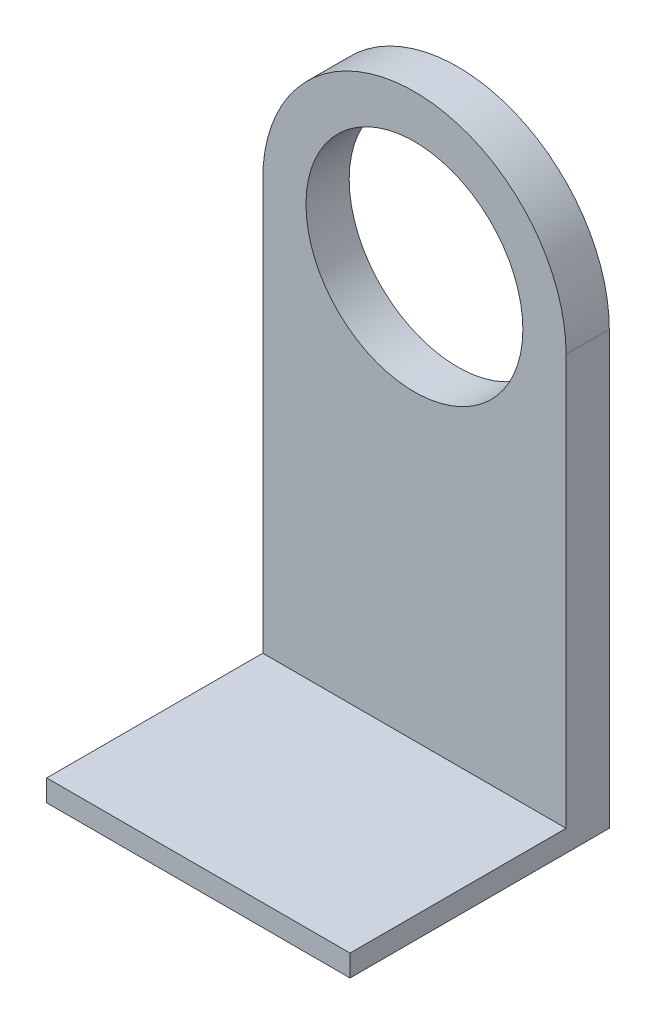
SolidWorks part; units mm, degrees
ref_plane "Front Plane" through (0, 0, 0) normal (0, 0, 1) x (1, 0, 0)
ref_plane "Top Plane" through (0, 0, 0) normal (0, 1, 0) x (1, 0, 0)
ref_plane "Right Plane" through (0, 0, 0) normal (1, 0, 0) x (0, 0, -1)
sketch "Sketch1" plane through (0, 0, 0) normal (0, 0, 1) x (1, 0, 0)
  line L0 (44.575, 0) -> (44.575, -127)
  line L1 (44.575, -127) -> (-44.575, -127)
  line L2 (-44.575, 0) -> (-44.575, -127)
  circle A0 centre (0, 0) radius 31.875
  arc A1 (44.575, 0) -> (-44.575, 0) centre (0, 0) ccw
  circle A2 centre (0, 0) radius 44.575 construction
  dimension "D1" = 63.75
  dimension "D3" = 127
  dimension "D2" = 12.7
extrude "Extrude1" add sketch "Sketch1" along normal blind 12.7
sketch "Sketch2" plane through (0, 0, 12.7) normal (0, 0, 1) x (1, 0, 0)
  line L0 (-44.575, -127) -> (44.575, -127) construction
  line L1 (-44.575, -127) -> (44.575, -127)
  line L2 (-44.575, -120.65) -> (44.575, -120.65)
  line L3 (44.575, -127) -> (44.575, 0) construction
  line L4 (44.575, -127) -> (44.575, -120.65)
  line L5 (-44.575, 0) -> (-44.575, -127) construction
  line L6 (-44.575, -120.65) -> (-44.575, -127)
  dimension "D1" = 6.35
extrude "Extrude2" add sketch "Sketch2" along normal blind 63.5
